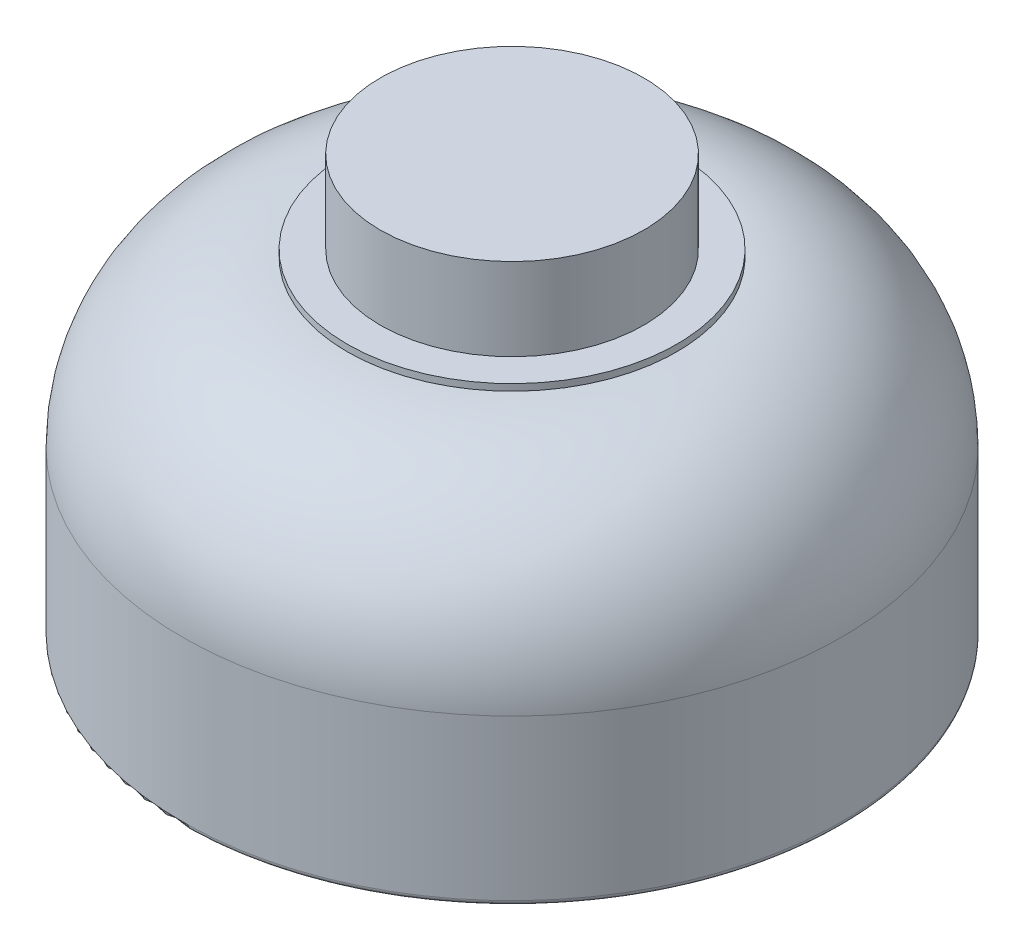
SolidWorks part; units mm, degrees
ref_plane "Alzado" through (0, 0, 0) normal (0, 0, 1) x (1, 0, 0)
ref_plane "Planta" through (0, 0, 0) normal (0, 1, 0) x (1, 0, 0)
ref_plane "Vista lateral" through (0, 0, 0) normal (1, 0, 0) x (0, 0, -1)
sketch "Croquis1" plane through (0, 0, 0) normal (0, 0, 1) x (1, 0, 0)
  line L0 (0, 30) -> (0, -70)
  line L1 (50, 30) -> (0, 30)
  line L2 (100, -20) -> (100, -70)
  line L3 (100, -70) -> (0, -70)
  line L5 (100, 30) -> (0, 0) construction
  line L6 (100, -70) -> (0, 0) construction
  arc A0 (50, 30) -> (100, -20) centre (50, -20) cw
  point P0 (0, 0)
  dimension "D3" = 50
  dimension "D1" = 100
  dimension "D2" = 100
revolve "Revolución1" add sketch "Croquis1" angle 360 about L0
shell "Vaciado1" thickness 3
fillet "Redondeo1" radius 1.5 2 edges at (-100, -70, 0) (-97, -70, 0)
sketch "Croquis2" plane through (0, 27, 0) normal (0, -1, 0) x (1, 0, 0)
  circle A0 centre (0, 0) radius 50
  dimension "D1" = 100
extrude "Saliente-Extruir1" add sketch "Croquis2" along normal blind 2 separate body
sketch "Croquis3" plane through (0, 25, 0) normal (0, -1, 0) x (1, 0, 0)
  circle A1 centre (0, 0) radius 50
  circle A2 centre (0, 0) radius 50
  dimension "D1" = 0
extrude "Saliente-Extruir2" add sketch "Croquis3" along normal blind 20 separate body
sketch "Croquis4" plane through (0, 5, 0) normal (0, -1, 0) x (1, 0, 0)
  circle A1 centre (0, 0) radius 50
  circle A2 centre (0, 0) radius 50
  dimension "D1" = 0
extrude "Saliente-Extruir3" add sketch "Croquis4" along normal blind 15 separate body
fillet "Redondeo2" radius 10 1 edges at (0, -10, -50)
sketch "Croquis5" plane through (0, 30, 0) normal (0, 1, 0) x (1, 0, 0)
  circle A0 centre (0, 0) radius 50
  dimension "D1" = 100
extrude "Saliente-Extruir4" add sketch "Croquis5" along normal blind 2 separate body
sketch "Croquis10" plane through (0, 32, 0) normal (0, 1, 0) x (1, 0, 0)
  circle A0 centre (0, 0) radius 40
  dimension "D1" = 80
extrude "Saliente-Extruir8" add sketch "Croquis10" along normal blind 25
